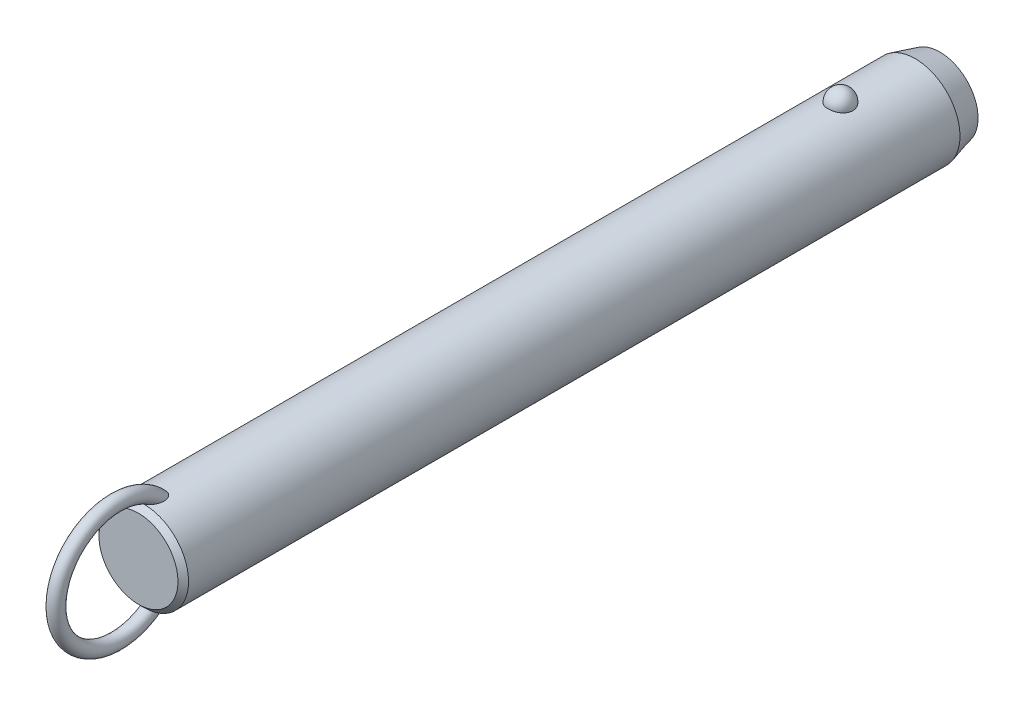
SolidWorks part; units mm, degrees
ref_plane "Front Plane" through (0, 0, 0) normal (0, 0, 1) x (1, 0, 0)
ref_plane "Top Plane" through (0, 0, 0) normal (0, 1, 0) x (1, 0, 0)
ref_plane "Right Plane" through (0, 0, 0) normal (1, 0, 0) x (0, 0, -1)
sketch "Sketch2" plane through (0, 0, 0) normal (0, 0, 1) x (1, 0, 0)
  circle A0 centre (0, 0) radius 12.7
  point P3 (0, 12.7)
  dimension "D1" = 25.4
extrude "Boss-Extrude1" add sketch "Sketch2" along normal blind 182.9
sketch "Sketch3" plane through (0, 0, 0) normal (0, 0, -1) x (-1, 0, 0)
  circle A0 centre (0, 0) radius 12.7
  dimension "D1" = 25.4
extrude "Boss-Extrude2" add sketch "Sketch3" along normal blind 31.7
chamfer "Chamfer1" distance 7 angle 15 1 edges at (-12.7, 0, -31.7)
sketch "Sketch12" plane through (0, 0, 0) normal (1, 0, 0) x (0, 0, -1)
  line L0 (-182.9, 12.7) -> (-182.9, -12.7) construction
  point P0 (-182.9, 0)
sketch "Sketch13" plane through (0, 0, 0) normal (1, 0, 0) x (0, 0, -1)
  circle A0 centre (-201.95, 0) radius 19.05
  point P2 (-182.9, 0)
  dimension "D1" = 38.1
sketch "Sketch14" plane through (0, 0, 0) normal (0, 1, 0) x (1, 0, 0)
  circle A0 centre (0, -184.9) radius 2
  point P2 (0, -182.9)
  dimension "D1" = 4
sweep "Sweep1" add profiles "Sketch14" path "Sketch13"
sketch "Sketch15" plane through (0, 0, 182.9) normal (0, 0, 1) x (1, 0, 0)
  circle A0 centre (0, 0) radius 12.7
  dimension "D1" = 25.4
extrude "Boss-Extrude3" add sketch "Sketch15" along normal blind 12.7
chamfer "Chamfer2" distance 1.5 angle 45 1 edges at (12.7, 0, 195.6)
sketch "Sketch18" plane through (0, 0, 0) normal (1, 0, 0) x (0, 0, -1)
  line L0 (24.7, 12.7) -> (-187.751, 12.7) construction
  line L1 (3.5, 16.2) -> (3.5, 9.2)
  line L2 (-187.751, -12.7) -> (24.7, -12.7) construction
  arc A0 (3.5, 16.2) -> (3.5, 9.2) centre (3.5, 12.7) ccw
  point P4 (0, 12.7)
  dimension "D1" = 28.9
revolve "Revolve1" add sketch "Sketch18" angle 360 about L1
